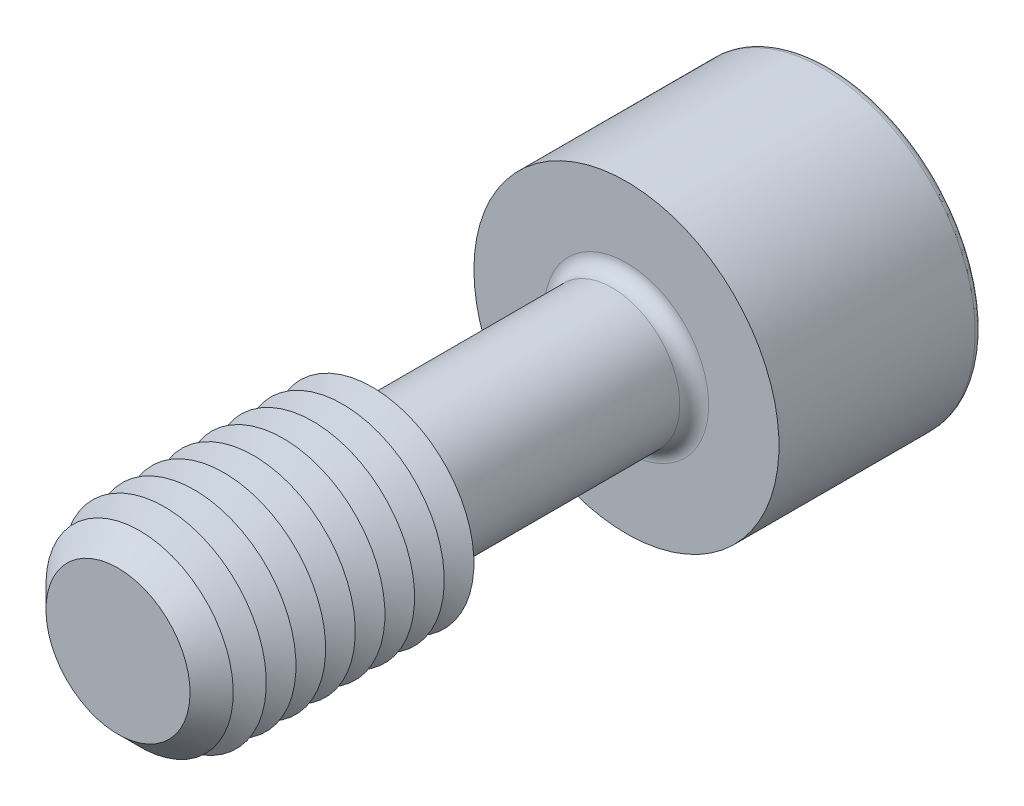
SolidWorks part; units mm, degrees
ref_plane "Front Plane" through (0, 0, 0) normal (0, 0, 1) x (1, 0, 0)
ref_plane "Top Plane" through (0, 0, 0) normal (0, 1, 0) x (1, 0, 0)
ref_plane "Right Plane" through (0, 0, 0) normal (1, 0, 0) x (0, 0, -1)
sketch "Sketch1" plane through (0, 0, 0) normal (0, 0, 1) x (1, 0, 0)
  circle A0 centre (0, 0) radius 4
  dimension "D1" = 8
extrude "Extrude1" add sketch "Sketch1" along normal mid plane 30
sketch "Sketch2" plane through (0, 0, 0) normal (1, 0, 0) x (0, 0, -1)
  line L0 (-15, 0) -> (-15, 6)
  line L1 (-15, 4) -> (-15, -4) construction
  line L2 (-15, 6) -> (0, 6)
  line L3 (0, 6) -> (1.1547, 4)
  line L4 (15, 4) -> (-15, 4) construction
  line L5 (1.1547, 4) -> (1.1547, 0)
  line L6 (1.1547, 0) -> (-15, 0)
  dimension "D1" = 6
  dimension "D2" = 120
  dimension "D3" = 15
revolve "Revolve1" add sketch "Sketch2" angle 360 about L6
chamfer "Chamfer1" distance 1.75 angle 45 1 edges at (0, 6, 15)
sketch "Sketch3" plane through (0, 0, -15) normal (0, 0, -1) x (-1, 0, 0)
  circle A0 centre (0, 0) radius 9
  dimension "D1" = 18
extrude "Extrude2" add sketch "Sketch3" along normal blind 12
sketch "Sketch4" plane through (-13.7, 0, -27) normal (0, 0, 1) x (1, 0, 0)
  line L2 (10.8132, -5) -> (16.5868, -5)
  line L3 (16.5868, -5) -> (19.4735, 0)
  line L4 (19.4735, 0) -> (16.5868, 5)
  line L6 (16.5868, 5) -> (10.8132, 5)
  line L7 (10.8132, 5) -> (7.9265, 0)
  line L8 (7.9265, 0) -> (10.8132, -5)
  circle A0 centre (13.7, 0) radius 5 construction
  dimension "D1" = 10
extrude "Extrude3" cut sketch "Sketch4" along normal blind 10
fillet "Fillet1" radius 0.85 1 edges at (-4, 0, -15)
fillet "Fillet2" radius 0.425 1 edges at (-9, 0, -27)
sketch "Sketch5" plane through (0, 0, 0) normal (1, 0, 0) x (0, 0, -1)
  line L0 (17, 0) -> (17, -5)
  line L1 (17, -5) -> (14.1132, 0)
  line L2 (14.1132, 0) -> (17, 0)
  dimension "D1" = 30
revolve "Cut-Revolve1" cut sketch "Sketch5" angle 360 about L2
sketch "Sketch6" plane through (0, 0, 0) normal (1, 0, 0) x (0, 0, -1)
  line L0 (1.332, 0) -> (-13.289, 0) construction
sketch "Sketch7" plane through (0, 0, 0) normal (1, 0, 0) x (0, 0, -1)
  line L0 (0, 6) -> (-0.875, 4.4845)
  line L1 (-0.875, 4.4845) -> (-1.75, 6)
  line L2 (0, 6) -> (-13.25, 6) construction
  line L3 (-1.75, 6) -> (0, 6)
  dimension "D1" = 1.75
revolve "Cut-Revolve2" cut sketch "Sketch7" angle 360 about L0
pattern_linear "LPattern1" count 8 spacing 1.75 along (0, 0, 1) of "Cut-Revolve2"
